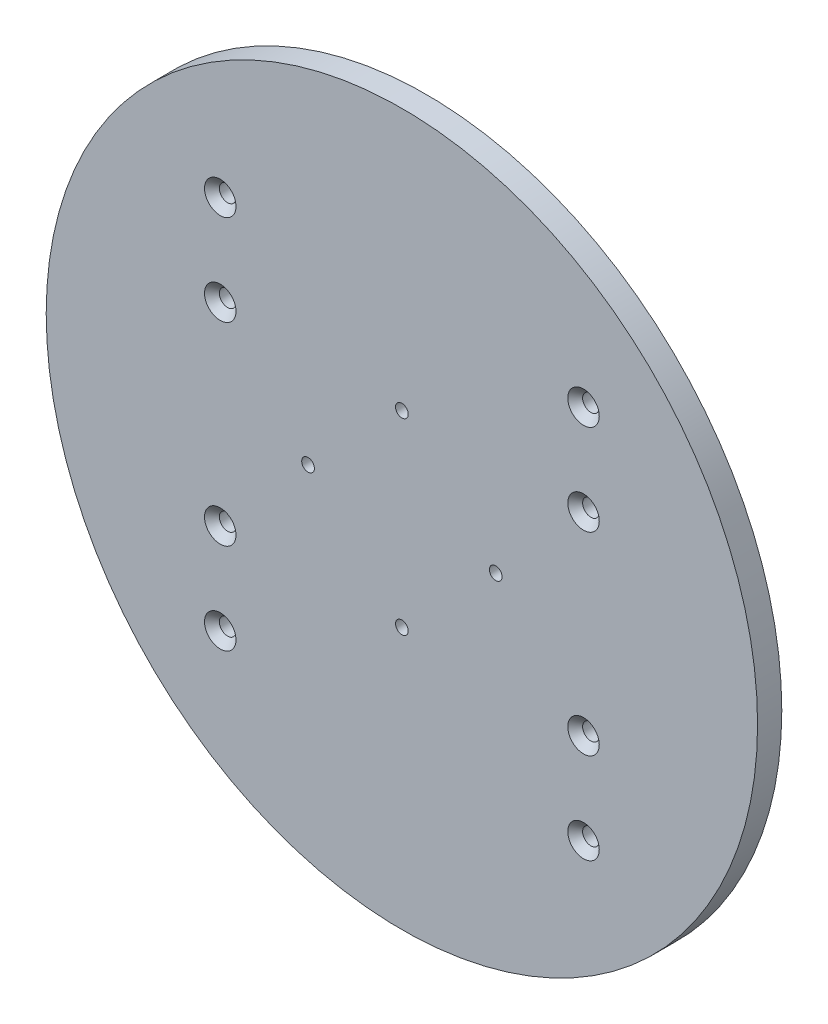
SolidWorks part; units mm, degrees
ref_plane "Przednia" through (0, 0, 0) normal (0, 0, 1) x (1, 0, 0)
ref_plane "Górna" through (0, 0, 0) normal (0, 1, 0) x (1, 0, 0)
ref_plane "Prawa" through (0, 0, 0) normal (1, 0, 0) x (0, 0, -1)
sketch "Szkic1" plane through (0, 0, 0) normal (0, 0, 1) x (1, 0, 0)
  circle A0 centre (0, 0) radius 117.5
  dimension "D1" = 235
extrude "Dodanie-wyciągnięcie1" add sketch "Szkic1" along normal blind 8
hole_wizard "Pogłębienie stożkowe pod M5 wkręt do części metalowych z łbem soczewkowym1" positions "Szkic3" profile "Szkic2" countersink size "M5" standard "Ansi Metric"
sketch "Szkic3" plane through (0, 0, 8) normal (0, 0, 1) x (1, 0, 0)
  line L1 (-60, -32) -> (60, -32)
  line L2 (-60, -32) -> (-60, 32)
  line L3 (-60, 32) -> (60, 32)
  line L4 (60, -32) -> (60, 32)
  line L5 (-60, 0) -> (0, 0) construction
  line L7 (0, 0) -> (0, 32) construction
  line L8 (-60, 32) -> (-60, 62)
  line L9 (-60, 62) -> (60, 62)
  line L10 (60, 62) -> (60, 32)
  line L12 (60, -32) -> (60, -62)
  line L13 (60, -62) -> (-60, -62)
  line L14 (-60, -62) -> (-60, -32)
  point P0 (-60, -32)
  point P6 (60, 32)
  point P13 (-60, 32)
  point P14 (60, -32)
  point P132 (-60, 62)
  point P134 (60, 62)
  point P139 (60, -62)
  point P141 (-60, -62)
  dimension "D1" = 120
  dimension "D2" = 64
  dimension "D3" = 30
  dimension "D4" = 30
sketch "Szkic2" plane through (-60, -32, 8) normal (1, 0, 0) x (0, -1, 0)
  line L0 (0, 0) -> (0, 8)
  line L1 (0, 8) -> (2.75, 8)
  line L2 (2.75, 8) -> (2.75, 2.45)
  line L3 (2.75, 2.45) -> (5.2, 0)
  line L5 (5.2, 0) -> (0, 0)
  line L6 (-2.75, 2.45) -> (-5.2, 0) construction
  line L11 (0, -6.35) -> (0, 107.95) construction
  dimension "Średnica otworu na wylot" = 5.5
  dimension "Głębokość otworu na wylot" = 8
  dimension "Średnica zewnętrznego pogłębienia stożkowego" = 10.4
  dimension "Kąt zewnętrznego pogłębienia stożkowego" = 90
hole_wizard "Otwór gwintowany M5x0.81" positions "Szkic5" profile "Szkic4" tap size "M5x0.8" standard "Ansi Metric"
sketch "Szkic5" plane through (0, 0, 8) normal (0, 0, 1) x (1, 0, 0)
  line L0 (0, 0) -> (0, 31) construction
  point P0 (0, 31)
  point P12 (31, 0)
  point P13 (0, -31)
  point P14 (-31, 0)
  dimension "D1" = 31
  dimension "D2" = 4
sketch "Szkic4" plane through (0, 31, 8) normal (1, 0, 0) x (0, -1, 0)
  line L0 (0, 0) -> (0, 8)
  line L1 (0, 8) -> (2.1, 8)
  line L2 (2.1, 8) -> (2.1, 0)
  line L5 (2.1, 0) -> (0, 0)
  line L11 (0, -6.35) -> (0, 107.95) construction
  dimension "Średnica otworu gwintowanego na wylot" = 4.2
  dimension "Głębokość otworu gwintowanego na wylot" = 8
